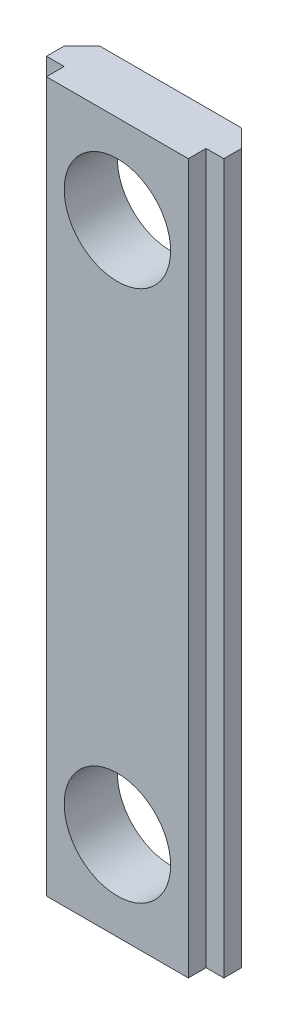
SolidWorks part; units mm, degrees
ref_plane "Plan de face" through (0, 0, 0) normal (0, 0, 1) x (1, 0, 0)
ref_plane "Plan de dessus" through (0, 0, 0) normal (0, 1, 0) x (1, 0, 0)
ref_plane "Plan de droite" through (0, 0, 0) normal (1, 0, 0) x (0, 0, -1)
sketch "Esquisse1" plane through (0, 0, 0) normal (0, 1, 0) x (1, 0, 0)
  line L0 (0, 0) -> (8, 0)
  line L1 (8, 0) -> (9, -0.9997)
  line L2 (9, -0.9997) -> (9, -2)
  line L3 (9, -2) -> (8, -2)
  line L4 (8, -2) -> (8, -3)
  line L5 (8, -3) -> (0, -3)
  line L6 (0, -3) -> (0, -2)
  line L7 (0, -2) -> (-1, -2)
  line L8 (-1, -2) -> (-1, -0.9997)
  line L9 (-1, -0.9997) -> (0, 0)
  dimension "D1" = 8
  dimension "D2" = 1
  dimension "D3" = 1
  dimension "D4" = 2
  dimension "D5" = 1
  dimension "D6" = 1
  dimension "D7" = 1.414
  dimension "D8" = 1.414
  dimension "D9" = 8
extrude "Extrusion1" add sketch "Esquisse1" along normal blind 40
sketch "Esquisse2" plane through (0, 0, 3) normal (0, 0, 1) x (1, 0, 0)
  line L0 (0, 0) -> (8, 0) construction
  line L1 (8, 40) -> (8, 0) construction
  circle A0 centre (4, 35) radius 3
  circle A1 centre (4, 5) radius 3
  dimension "D1" = 6
  dimension "D2" = 6
  dimension "D3" = 30
  dimension "D4" = 5
  dimension "D5" = 4
extrude "Extrusion2" cut sketch "Esquisse2" against normal up to next
